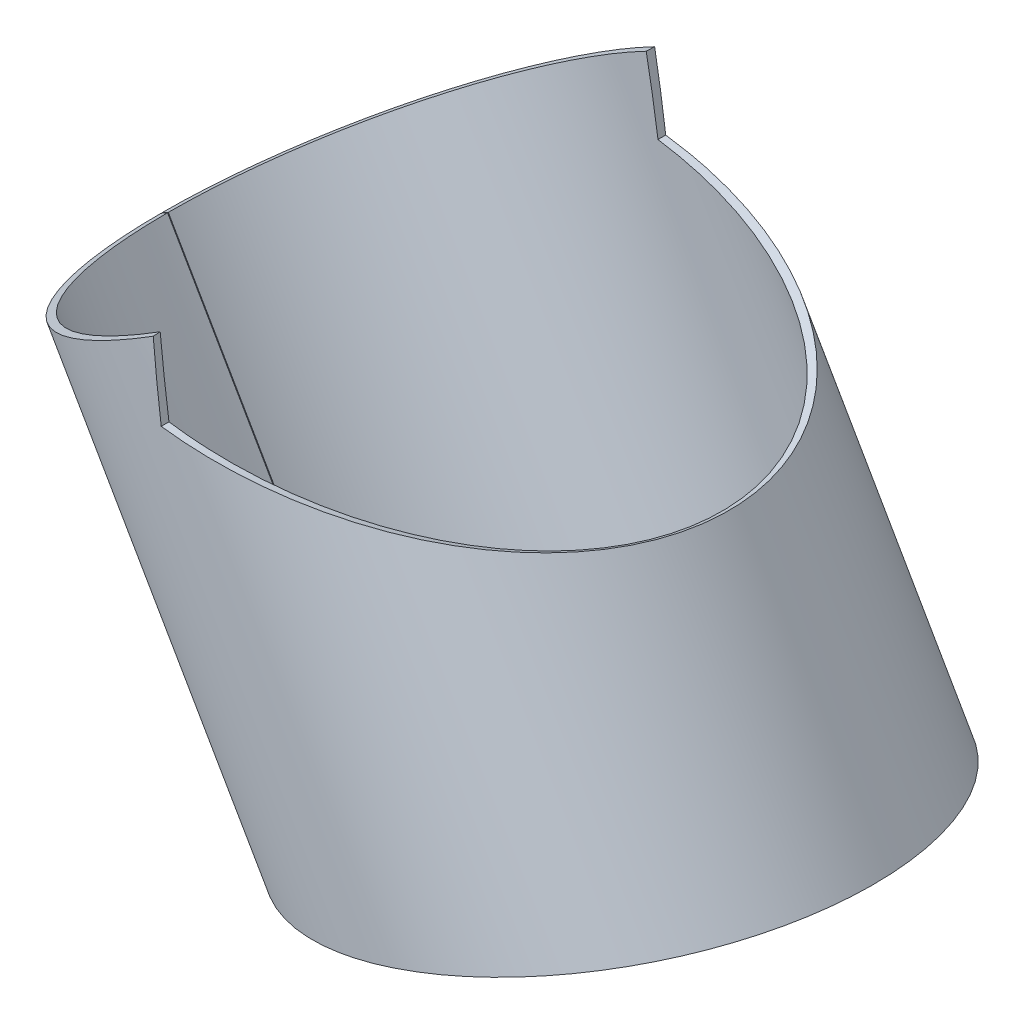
SolidWorks part; units mm, degrees
ref_plane "前视基准面" through (0, 0, 0) normal (0, 0, 1) x (1, 0, 0)
ref_plane "上视基准面" through (0, 0, 0) normal (0, 1, 0) x (1, 0, 0)
ref_plane "右视基准面" through (0, 0, 0) normal (1, 0, 0) x (0, 0, -1)
imported_body "基体零件-圆管斜插四节直角弯头-1"
sheet metal parameters "钣金1" parameters "D1"=0.7366, "厚度"=10
bend "圆角折弯1" bend radius 315 bend angle 359.824 parameters "D5"=1
flatten bends "展开-折弯1" parameters "D1"=0
sketch "尖角-草图1" plane through (-458.9742, 412.9167, 0.5) normal (-0.866, -0.5, 0.0015) x (0.0013, 0.0008, 1)
  line L0 (989.1171, 267.9492) -> (989.1171, -267.9492) construction
process bends "加工-折弯1" parameters "D1"=0
sketch "平面-草图1" plane through (-458.9742, 412.9167, 0.5) normal (-0.866, -0.5, 0.0015) x (0.0013, 0.0008, 1)
